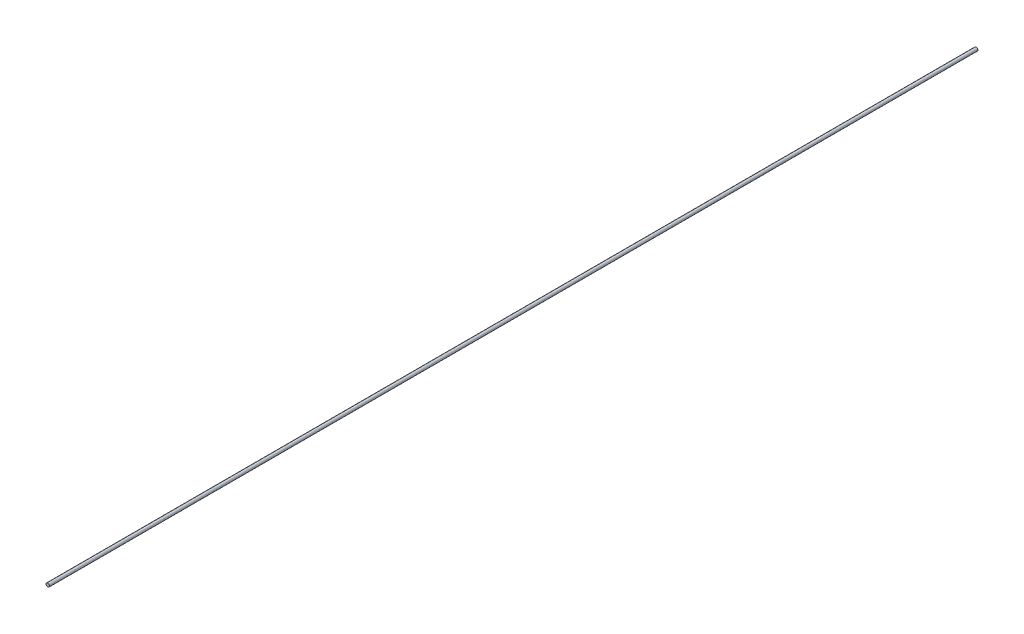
SolidWorks part; units mm, degrees
ref_plane "Front Plane" through (0, 0, 0) normal (0, 0, 1) x (1, 0, 0)
ref_plane "Top Plane" through (0, 0, 0) normal (0, 1, 0) x (1, 0, 0)
ref_plane "Right Plane" through (0, 0, 0) normal (1, 0, 0) x (0, 0, -1)
sketch "Sketch1" plane through (0, 0, 0) normal (0, 0, 1) x (1, 0, 0)
  circle A0 centre (0, 0) radius 1.9812
  dimension "D1" = 3.9624
extrude "Boss-Extrude1" add sketch "Sketch1" along normal blind 1066.8
